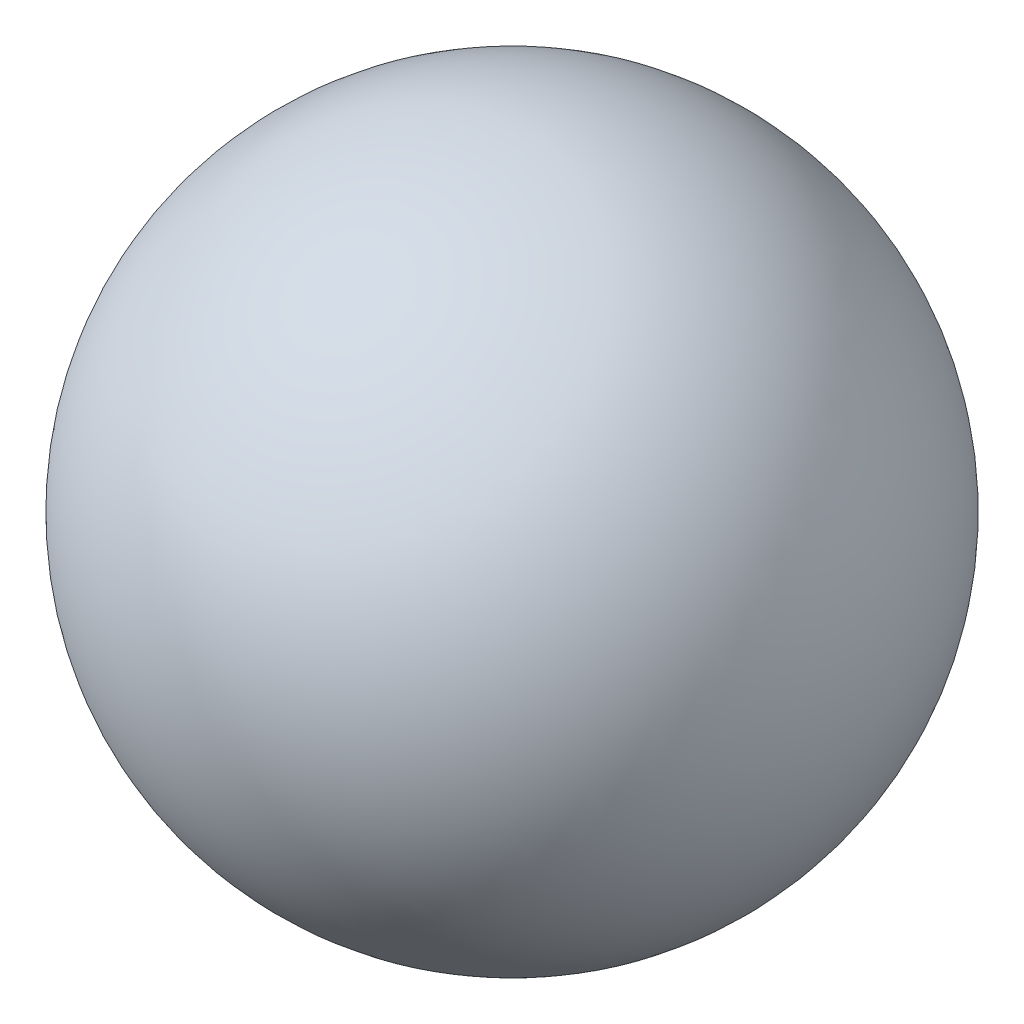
SolidWorks part; units mm, degrees
ref_plane "Plan1" through (0, 0, 0) normal (0, 0, 1) x (1, 0, 0)
ref_plane "Plan2" through (0, 0, 0) normal (0, 1, 0) x (1, 0, 0)
ref_plane "Plan3" through (0, 0, 0) normal (1, 0, 0) x (0, 0, -1)
sketch "Esquisse1" plane through (0, 0, 0) normal (0, 0, 1) x (1, 0, 0)
  line L0 (0, 80) -> (0, -100) construction
  line L1 (0, -5.5) -> (0, 5.5)
  arc A0 (0, 5.5) -> (0, -5.5) centre (0, 0) ccw
  dimension "D1" = 11
revolve "Base-Révolution" add sketch "Esquisse1" angle 360 about L0
